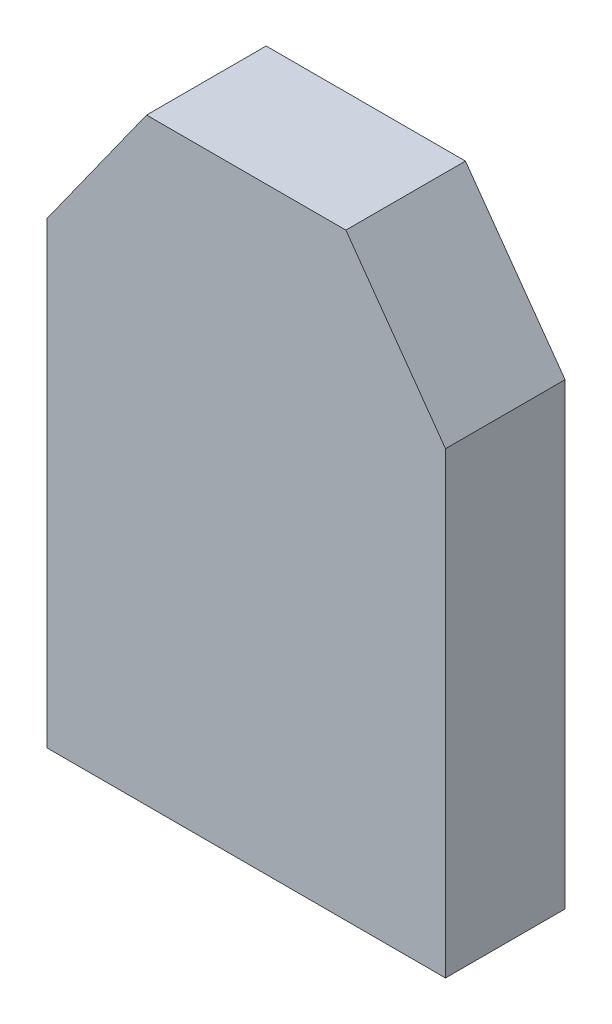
SolidWorks part; units mm, degrees
ref_plane "前视基准面" through (0, 0, 0) normal (0, 0, 1) x (1, 0, 0)
ref_plane "上视基准面" through (0, 0, 0) normal (0, 1, 0) x (1, 0, 0)
ref_plane "右视基准面" through (0, 0, 0) normal (1, 0, 0) x (0, 0, -1)
sketch "草图1" plane through (0, 0, 0) normal (0, 0, 1) x (1, 0, 0)
  line L0 (0, -26.8761) -> (0, 73.501) construction
  line L1 (10, 60) -> (-10, 60)
  line L2 (-10, 60) -> (-20, 46)
  line L3 (-20, 46) -> (-20, 0)
  line L4 (-20, 0) -> (20, 0)
  line L5 (20, 46) -> (20, 0)
  line L6 (10, 60) -> (20, 46)
  point P9 (0, 0)
  point P11 (0, 60)
  dimension "D1" = 10
  dimension "D2" = 20
  dimension "D3" = 46
  dimension "D4" = 60
extrude "凸台-拉伸1" add sketch "草图1" along normal blind 12
sketch "草图2" plane through (0, 0, 12) normal (0, 0, 1) x (1, 0, 0)
  line L0 (0, -1.1644) -> (0, 61.4244) construction
  line L1 (-14.0566, 42.3115) -> (13.7229, 42.3115) construction
  circle A0 centre (0, 42.3115) radius 10
  dimension "D1" = 20
sketch "草图3" plane through (0, 0, 12) normal (0, 0, 1) x (1, 0, 0)
  line L0 (0, 55.5591) -> (0, 6.2092) construction
  line L1 (0, -1.1644) -> (0, 61.4244) construction
  line L2 (-10, 23.8052) -> (10, 23.8052)
  line L3 (10, 23.8052) -> (10, 8.7373)
  line L4 (10, 8.7373) -> (-10, 8.7373)
  line L5 (-10, 23.8052) -> (-10, 8.7373)
  point P9 (0, 8.7373)
  point P10 (0, 23.8052)
